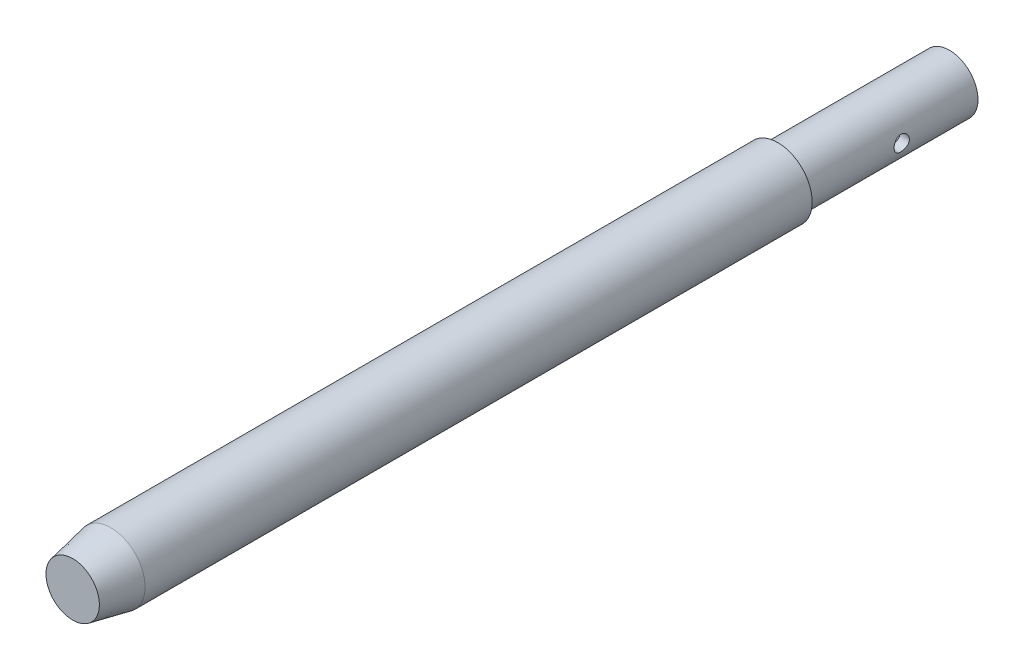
SolidWorks part; units mm, degrees
ref_plane "前视基准面" through (0, 0, 0) normal (0, 0, 1) x (1, 0, 0)
ref_plane "上视基准面" through (0, 0, 0) normal (0, 1, 0) x (1, 0, 0)
ref_plane "右视基准面" through (0, 0, 0) normal (1, 0, 0) x (0, 0, -1)
sketch "草图1" plane through (0, 0, 0) normal (0, 0, 1) x (1, 0, 0)
  circle A0 centre (0, 0) radius 9
extrude "凸台-拉伸1" add sketch "草图1" along normal blind 185
chamfer "倒角1" distance 10 distance2 2 1 edges at (9, 0, 185)
sketch "草图2" plane through (0, 0, 0) normal (0, 0, -1) x (-1, 0, 0)
  circle A0 centre (0, 0) radius 7.5
extrude "凸台-拉伸2" add sketch "草图2" along normal blind 45
sketch "草图3" plane through (0, 0, -45) normal (0, 0, -1) x (-1, 0, 0)
  circle A0 centre (0, 0) radius 5
extrude "切除-拉伸1" cut sketch "草图3" against normal blind 35
ref_plane "基准面1" through (10, 0, 0) normal (1, 0, 0) x (0, 0, -1)
sketch "草图4" plane through (10, 0, 0) normal (1, 0, 0) x (0, 0, -1)
  line L0 (45, -7.5) -> (45, 7.5) construction
  circle A0 centre (25, 0) radius 2
  dimension "D1" = 20
extrude "切除-拉伸2" cut sketch "草图4" against normal up to next
